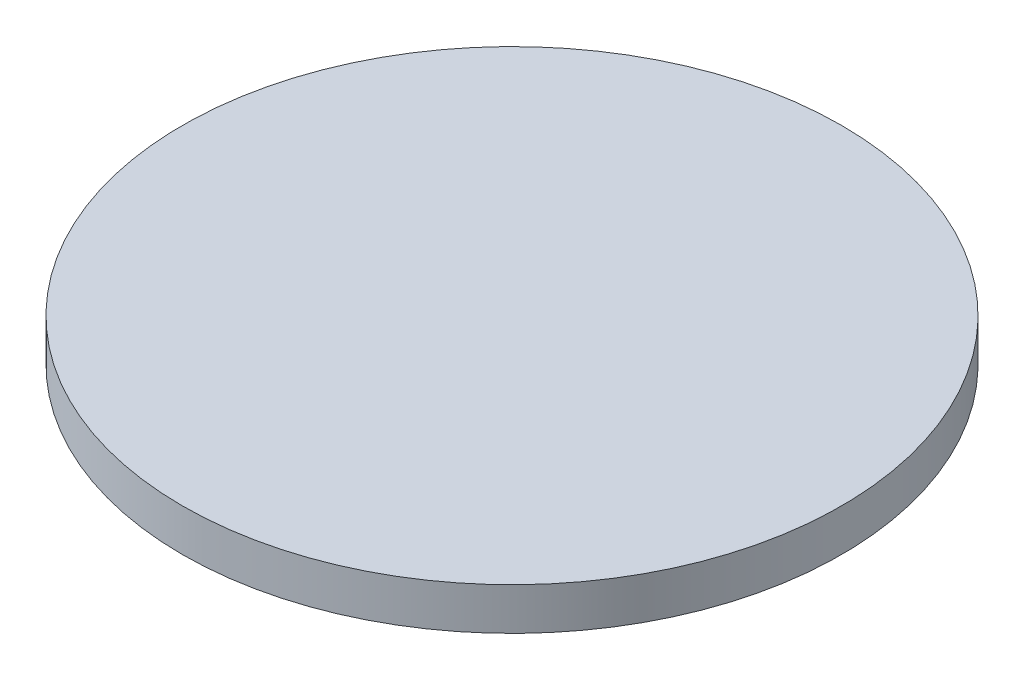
SolidWorks part; units mm, degrees
ref_plane "Front Plane" through (0, 0, 0) normal (0, 0, 1) x (1, 0, 0)
ref_plane "Top Plane" through (0, 0, 0) normal (0, 1, 0) x (1, 0, 0)
ref_plane "Right Plane" through (0, 0, 0) normal (1, 0, 0) x (0, 0, -1)
sketch "Sketch2" plane through (0, 0, 0) normal (0, 1, 0) x (1, 0, 0)
  circle A0 centre (0, 0) radius 19.8438
  dimension "D1" = 39.6875
extrude "Boss-Extrude2" add sketch "Sketch2" along normal blind 2.54 contours A0
